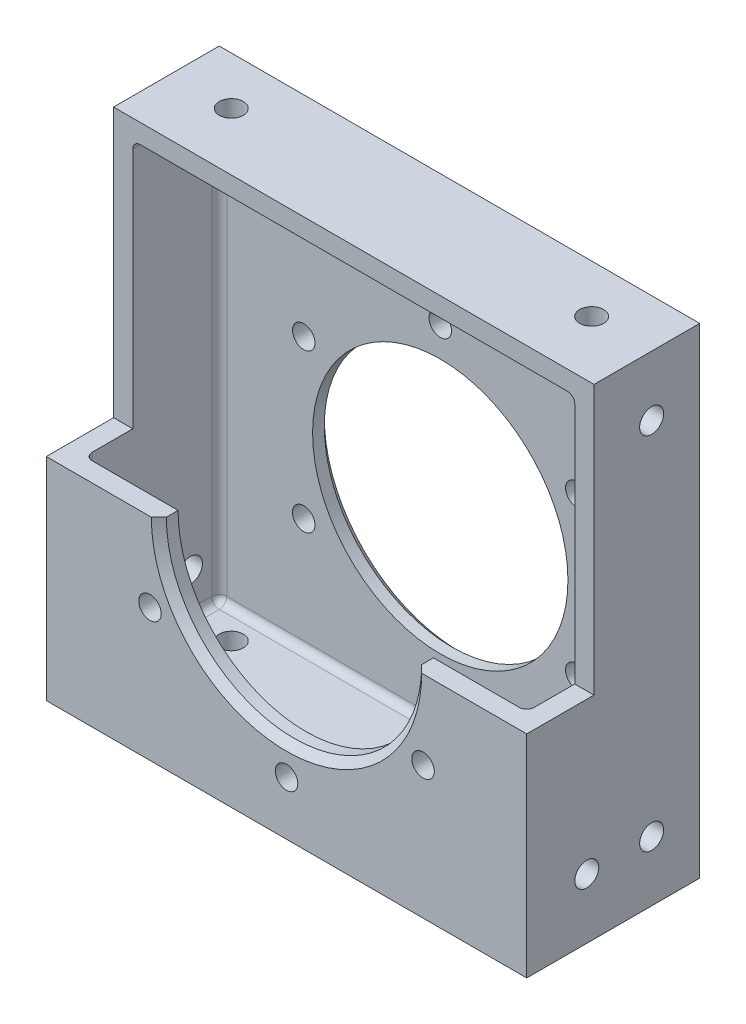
SolidWorks part; units mm, degrees
ref_plane "Front" through (0, 0, 0) normal (0, 0, 1) x (1, 0, 0)
ref_plane "Top" through (0, 0, 0) normal (0, 1, 0) x (1, 0, 0)
ref_plane "Right" through (0, 0, 0) normal (1, 0, 0) x (0, 0, -1)
sketch "Sketch6" plane through (0, 59.3429, 0) normal (1, 0, 0) x (0, 0, -1)
  line L0 (7.112, -8.5429) -> (18.288, -8.5429)
  line L1 (18.288, -8.5429) -> (18.288, -59.3429)
  line L2 (0, -59.3429) -> (18.288, -59.3429)
  line L3 (0, -36.9909) -> (0, -59.3429)
  line L4 (7.112, -36.9909) -> (0, -36.9909)
  line L5 (7.112, -36.9909) -> (7.112, -8.5429)
  dimension "D1" = 50.8
  dimension "D2" = 11.176
  dimension "D3" = 18.288
  dimension "D4" = 22.352
extrude "Base-Extrude" add sketch "Sketch6" against normal blind 50.8
shell "Shell1" thickness 2.032
sketch "Sketch7" plane through (0, 0, 0) normal (0, 0, 1) x (1, 0, 0)
  line L0 (-50.8, 22.352) -> (0, 22.352) construction
  circle A0 centre (-25.4, 22.352) radius 13.5001
  dimension "D1" = 27.0002
extrude "Cut-Extrude1" cut sketch "Sketch7" against normal through all
sketch "Sketch8" plane through (0, 0, 0) normal (1, 0, 0) x (0, 0, -1)
  line L0 (13.208, 44.45) -> (13.208, 6.35) construction
  line L1 (18.288, 0) -> (18.288, 50.8) construction
  line L2 (18.288, 50.8) -> (7.112, 50.8) construction
  line L3 (0, 0) -> (18.288, 0) construction
  line L4 (13.208, 6.35) -> (6.35, 6.35) construction
  line L6 (0, 22.352) -> (0, 0) construction
  circle A0 centre (13.208, 44.45) radius 1.27
  circle A1 centre (13.208, 6.35) radius 1.27
  circle A2 centre (6.35, 6.35) radius 1.27
  dimension "D1" = 5.08
  dimension "D2" = 2.54
  dimension "D3" = 6.35
  dimension "D4" = 6.35
  dimension "D5" = 6.35
extrude "Cut-Extrude2" cut sketch "Sketch8" against normal through all
sketch "Sketch9" plane through (0, 50.8, 0) normal (0, 1, 0) x (-1, 0, 0)
  line L0 (25.4, 4.5299) -> (25.4, -26.4748) construction
  line L1 (50.8, -18.288) -> (50.8, -7.112) construction
  line L3 (25.4, -2.032) -> (25.4, 0) construction
  line L4 (2.032, -13.208) -> (0, -13.208) construction
  circle A0 centre (44.45, -13.208) radius 1.27
  circle A1 centre (6.35, -13.208) radius 1.27
  dimension "D3" = 2.54
  dimension "D1" = 6.35
extrude "Cut-Extrude3" cut sketch "Sketch9" against normal through all
sketch "Sketch10" plane through (0, 0, -18.288) normal (0, 0, -1) x (-1, 0, 0)
  line L0 (25.4, 5.6833) -> (25.4, 22.352) construction
  circle A0 centre (25.4, 5.6833) radius 1.1906
  circle A1 centre (25.4, 22.352) radius 16.6687 construction
  dimension "D1" = 33.3375
  dimension "D2" = 2.3813
extrude "Cut-Extrude4" cut sketch "Sketch10" against normal through all
pattern_circular "CirPattern1" count 6 over 360 about axis through (-25.4, 22.352, 0) along (0, 0, 1) of "Cut-Extrude4"
fillet "Fillet1" radius 0.7937 4 edges at (-48.768, 25.4, -16.256) (-48.768, 12.192, -2.032) (-2.032, 12.192, -2.032) (-2.032, 25.4, -16.256)
fillet "Fillet2" radius 0.7937 13 edges at (-48.768, 2.032, -9.144) (-48.768, 48.768, -11.2871) (-2.032, 48.768, -11.2871) (-25.4, 48.768, -16.256) (-2.2645, 48.768, -16.0235) (-48.5355, 48.768, -16.0235) (-25.4, 2.032, -16.256) (-2.032, 2.032, -9.144) (-25.4, 2.032, -2.032) (-48.5355, 2.032, -2.2645) (-2.2645, 2.032, -2.2645) (-2.2645, 2.032, -16.0235) (-48.5355, 2.032, -16.0235)
chamfer "Chamfer1" distance 0.7937 angle 45 2 edges at (-11.8999, 22.352, -18.288) (-25.4, 8.8519, 0)
